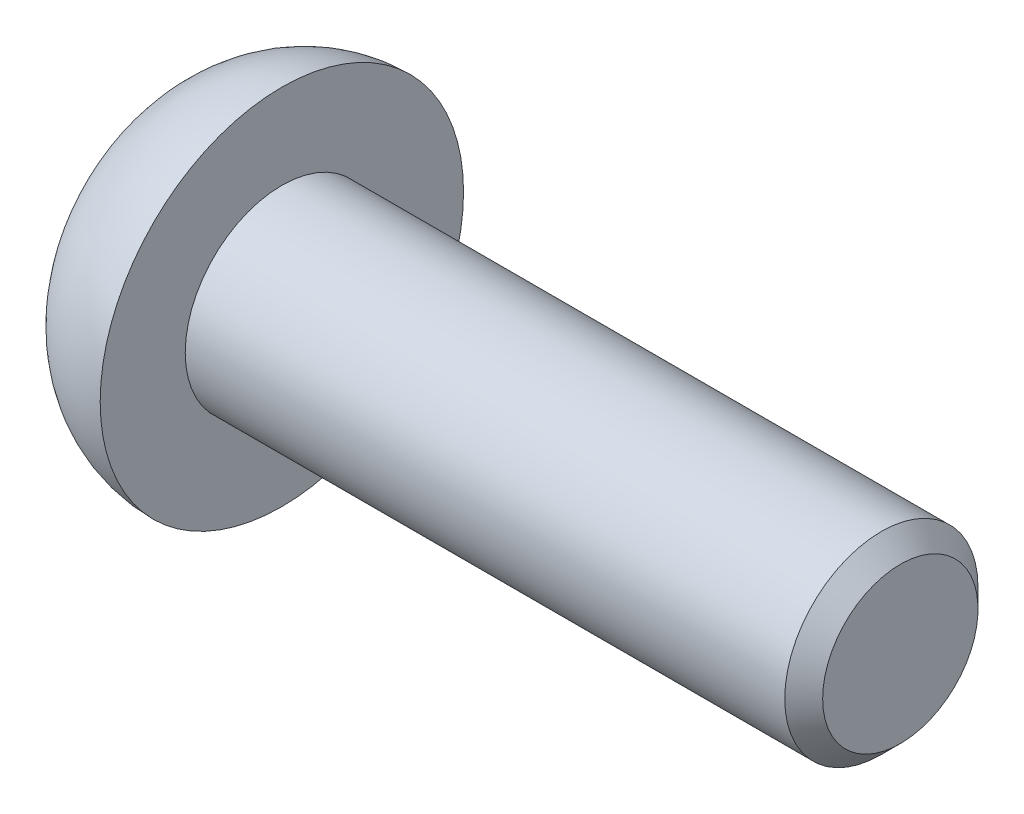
SolidWorks part; units mm, degrees
ref_plane "Plan de face" through (0, 0, 0) normal (0, 0, 1) x (1, 0, 0)
ref_plane "Plan de dessus" through (0, 0, 0) normal (0, 1, 0) x (1, 0, 0)
ref_plane "Plan de droite" through (0, 0, 0) normal (1, 0, 0) x (0, 0, -1)
sketch "Esquisse1" plane through (0, 0, 0) normal (0, 0, 1) x (1, 0, 0)
  line L0 (-2.7, 0) -> (-2.7, 3.3619)
  line L1 (0, 4.7) -> (0, 2.5)
  line L2 (0, 2.5) -> (15.5095, 2.5)
  line L3 (15.5095, 2.5) -> (16, 2.0095)
  line L4 (16, 2.0095) -> (16, 0)
  line L5 (16, 0) -> (-2.7, 0)
  line L6 (16, 0) -> (-2.7, 0) construction
  arc A0 (-2.7, 3.3619) -> (0, 4.7) centre (0, 1.307) cw
revolve "Révolution1" add sketch "Esquisse1" angle 360 about L6
sketch "Esquisse2" plane through (0, 0, 0) normal (0, 0, 1) x (1, 0, 0)
  line L0 (-2.8, 0) -> (-2.8, 2.35)
  line L1 (-2.8, 2.35) -> (-2.655, 2.35)
  line L2 (-2.655, 2.35) -> (-2.0253, 0)
  line L3 (-2.0253, 0) -> (-2.8, 0)
  line L4 (-2.0253, 0) -> (-2.8, 0) construction
ref_plane "Plan1" through (-1.35, 0, 0) normal (1, 0, 0) x (0, 0, -1)
sketch "Esquisse3" plane through (-1.35, 0, 0) normal (1, 0, 0) x (0, 0, -1)
  arc A0 (-1.9123, 0.4398) -> (-1.9123, -0.4398) centre (-1.808, 0) ccw
  arc A1 (-1.9123, -0.4398) -> (-1.337, -1.4362) centre (-2.0948, -1.2095) cw
  arc A2 (-1.337, -1.4362) -> (-0.5753, -1.876) centre (-0.904, -1.5658) ccw
  arc A3 (-0.5753, -1.876) -> (0.5753, -1.876) centre (0, -2.4189) cw
  arc A4 (0.5753, -1.876) -> (1.337, -1.4362) centre (0.904, -1.5658) ccw
  arc A5 (1.337, -1.4362) -> (1.9123, -0.4398) centre (2.0948, -1.2095) cw
  arc A6 (1.9123, -0.4398) -> (1.9123, 0.4398) centre (1.808, 0) ccw
  arc A7 (1.9123, 0.4398) -> (1.337, 1.4362) centre (2.0948, 1.2095) cw
  arc A8 (1.337, 1.4362) -> (0.5753, 1.876) centre (0.904, 1.5658) ccw
  arc A9 (0.5753, 1.876) -> (-0.5753, 1.876) centre (0, 2.4189) cw
  arc A10 (-0.5753, 1.876) -> (-1.337, 1.4362) centre (-0.904, 1.5658) ccw
  arc A11 (-1.337, 1.4362) -> (-1.9123, 0.4398) centre (-2.0948, 1.2095) cw
ref_plane "Plan2" through (16, 0, 0) normal (1, 0, 0) x (0, 0, -1)
revolve "Enlèvement de matière-Révolution1" cut sketch "Esquisse2" angle 360 about L4
extrude "Enlèv. mat.-Extru.1" cut sketch "Esquisse3" against normal blind 2.7
